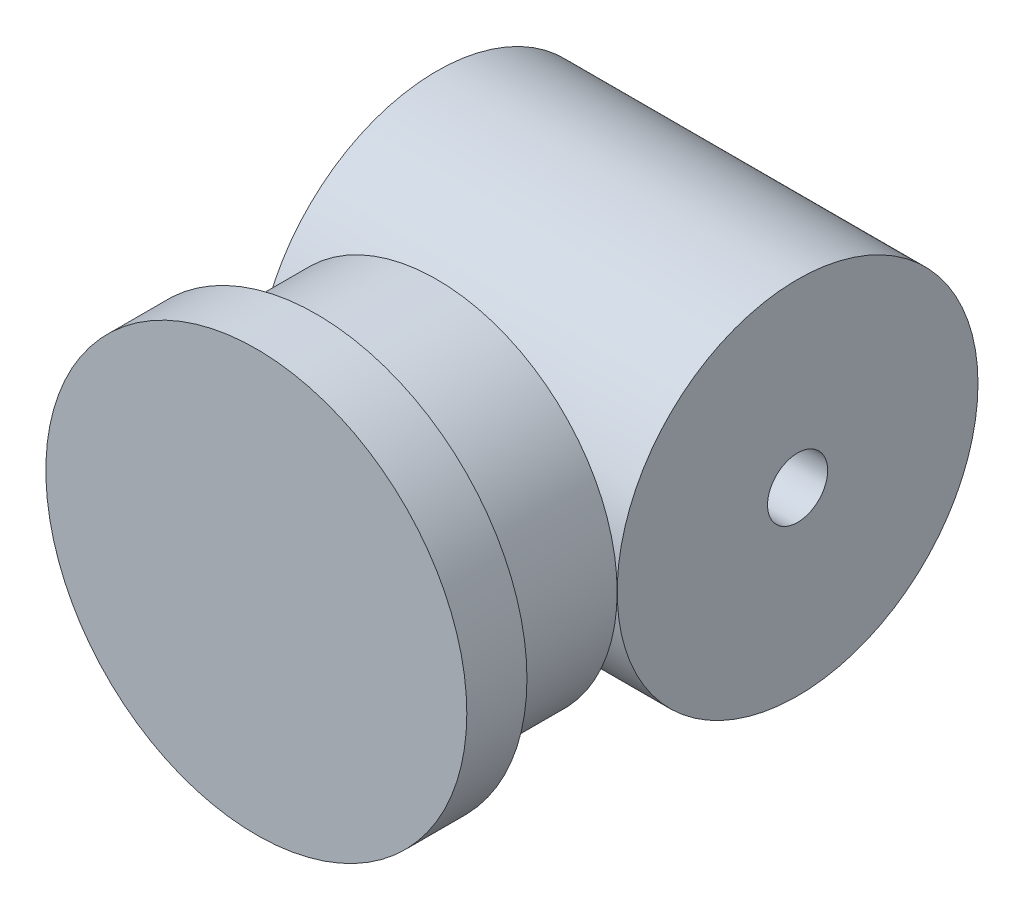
SolidWorks part; units mm, degrees
ref_plane "Front Plane" through (0, 0, 0) normal (0, 0, 1) x (1, 0, 0)
ref_plane "Top Plane" through (0, 0, 0) normal (0, 1, 0) x (1, 0, 0)
ref_plane "Right Plane" through (0, 0, 0) normal (1, 0, 0) x (0, 0, -1)
sketch "Sketch1" plane through (0, 0, 0) normal (0, 0, 1) x (1, 0, 0)
  circle A0 centre (0, 0) radius 30
  dimension "D1" = 60
extrude "Boss-Extrude1" add sketch "Sketch1" along normal blind 20
sketch "Sketch2" plane through (0, 0, 20) normal (0, 0, 1) x (1, 0, 0)
  circle A2 centre (0, 0) radius 35
  circle A3 centre (0, 0) radius 35
  dimension "D1" = 5
extrude "Boss-Extrude2" add sketch "Sketch2" along normal blind 10
sketch "Sketch3" plane through (0, 0, 0) normal (1, 0, 0) x (0, 0, -1)
  circle A0 centre (30, 0) radius 30
  dimension "D1" = 60
extrude "Boss-Extrude3" add sketch "Sketch3" along normal mid plane 60 separate body
sketch "Sketch4" plane through (30, 0, 0) normal (1, 0, 0) x (0, 0, -1)
  circle A0 centre (30, 0) radius 5
  dimension "D1" = 10
extrude "Cut-Extrude1" cut sketch "Sketch4" against normal through all
